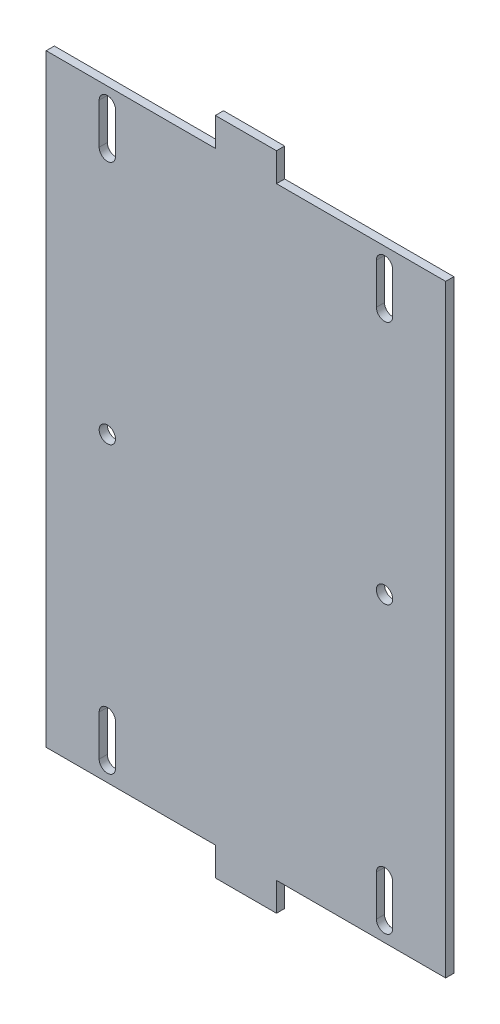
SolidWorks part; units mm, degrees
ref_plane "Plan de face" through (0, 0, 0) normal (0, 0, 1) x (1, 0, 0)
ref_plane "Plan de dessus" through (0, 0, 0) normal (0, 1, 0) x (1, 0, 0)
ref_plane "Plan de droite" through (0, 0, 0) normal (1, 0, 0) x (0, 0, -1)
sketch "Esquisse1" plane through (0, 0, 0) normal (0, 0, 1) x (1, 0, 0)
  line L0 (-66.0048, 0) -> (74.0054, 0) construction
  line L1 (0, 96.9396) -> (0, -89.5054) construction
  line L2 (-49, -74) -> (-49, 74)
  line L3 (-49, 74) -> (-7.5, 74)
  line L4 (-7.5, 74) -> (-7.5, 81)
  line L5 (-7.5, 81) -> (7.5, 81)
  line L6 (7.5, 74) -> (7.5, 81)
  line L7 (49, 74) -> (7.5, 74)
  line L8 (49, -74) -> (49, 74)
  line L9 (49, -74) -> (7.5, -74)
  line L10 (7.5, -74) -> (7.5, -81)
  line L11 (-7.5, -81) -> (7.5, -81)
  line L12 (-7.5, -74) -> (-7.5, -81)
  line L13 (-49, -74) -> (-7.5, -74)
  point P5 (0, -81)
  point P11 (0, 81)
  point P15 (49, 0)
  point P20 (-49, 0)
  dimension "D1" = 74
  dimension "D2" = 49
  dimension "D3" = 41.5
  dimension "D4" = 81
extrude "Extrusion1" add sketch "Esquisse1" along normal blind 2
sketch "Esquisse2" plane through (0, 0, 2) normal (0, 0, 1) x (1, 0, 0)
  line L0 (-34, 71.1798) -> (-34, 56.49) construction
  line L1 (-49, 74) -> (-49, -74) construction
  line L4 (-7.5, 74) -> (-49, 74) construction
  line L5 (-37.7127, 65) -> (-28.5415, 65) construction
  line L8 (-36, 70) -> (-36, 60)
  line L10 (-32, 70) -> (-32, 60)
  arc A0 (-36, 70) -> (-32, 70) centre (-34, 70) cw
  arc A1 (-36, 60) -> (-32, 60) centre (-34, 60) ccw
  dimension "D1" = 15
  dimension "D2" = 9
  dimension "D3" = 10
  dimension "D4" = 4
  dimension "D5" = 4
extrude "Enlèv. mat.-Extru.1" cut sketch "Esquisse2" against normal through all
pattern_linear "Répétition linéaire1" count 2 spacing 68 along (1, 0, 0) count 2 spacing 130 along (0, -1, 0) of "Enlèv. mat.-Extru.1"
sketch "Esquisse3" plane through (0, 0, 2) normal (0, 0, 1) x (1, 0, 0)
  line L0 (-49, 74) -> (-49, -74) construction
  line L1 (-7.5, 74) -> (-49, 74) construction
  circle A0 centre (-34, 0) radius 2
  dimension "D2" = 4
  dimension "D1" = 15
  dimension "D3" = 74
extrude "Enlèv. mat.-Extru.2" cut sketch "Esquisse3" against normal blind 10
pattern_linear "Répétition linéaire2" count 2 spacing 68 along (1, 0, 0) of "Enlèv. mat.-Extru.2"
